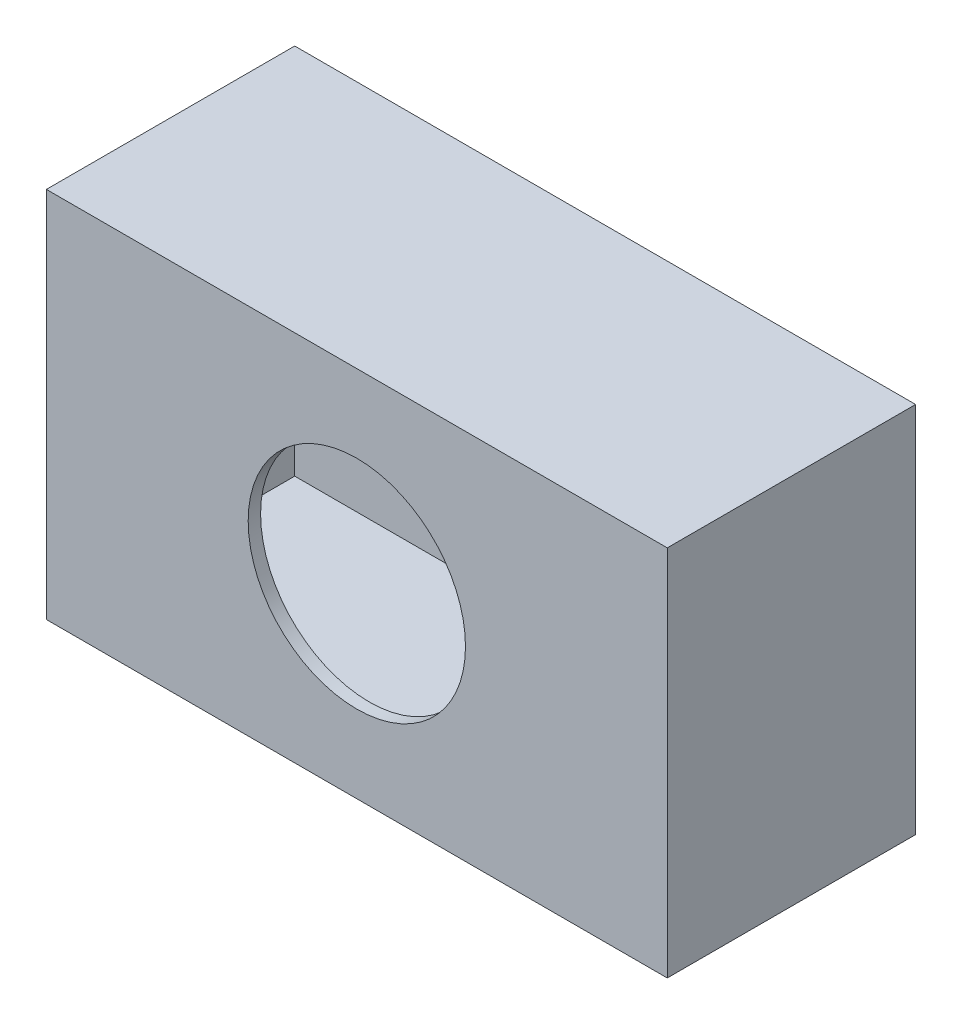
SolidWorks part; units mm, degrees
ref_plane "Płaszczyzna przednia" through (0, 0, 0) normal (0, 0, 1) x (1, 0, 0)
ref_plane "Płaszczyzna górna" through (0, 0, 0) normal (0, 1, 0) x (1, 0, 0)
ref_plane "Płaszczyzna prawa" through (0, 0, 0) normal (1, 0, 0) x (0, 0, -1)
sketch "Szkic1" plane through (0, 0, 0) normal (0, 0, 1) x (1, 0, 0)
  line L1 (50, -30) -> (-50, -30)
  line L2 (50, -30) -> (50, 30)
  line L3 (50, 30) -> (-50, 30)
  line L4 (-50, -30) -> (-50, 30)
  line L5 (50, -30) -> (-50, 30) construction
  line L6 (50, 30) -> (-50, -30) construction
  point P0 (0, 0)
  dimension "D1" = 100
  dimension "D2" = 60
extrude "Dodanie-wyciągnięcie1" add sketch "Szkic1" along normal blind 40
sketch "Szkic2" plane through (0, 0, 40) normal (0, 0, 1) x (1, 0, 0)
  circle A0 centre (0, 0) radius 17.5
  dimension "D1" = 35
shell "Skorupa1" thickness 2
